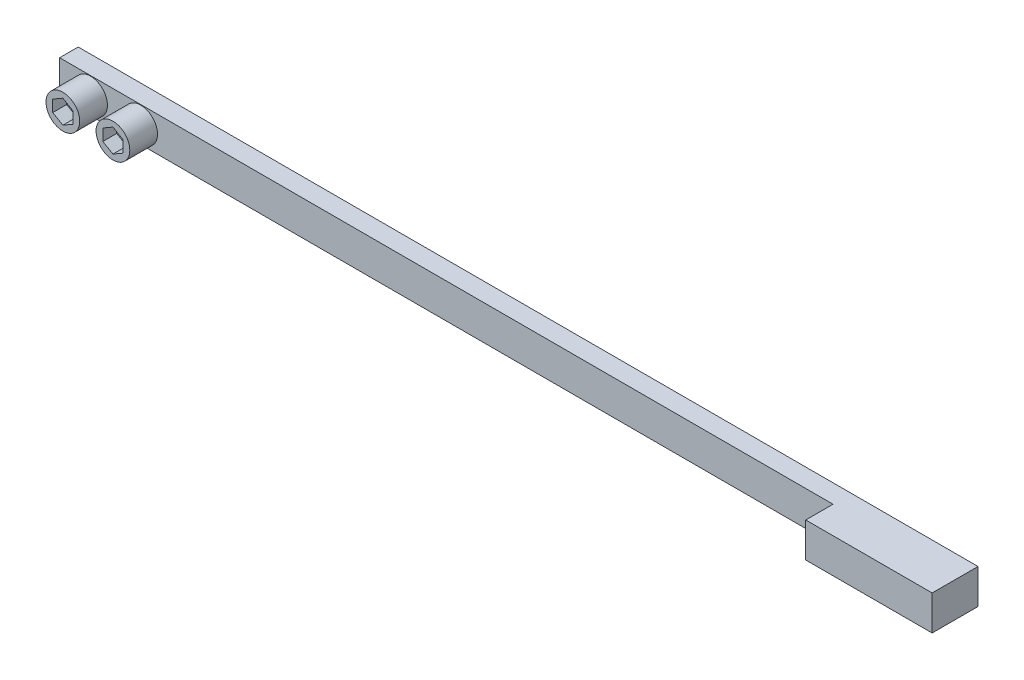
SolidWorks part; units mm, degrees
ref_plane "Front Plane" through (0, 0, 0) normal (0, 0, 1) x (1, 0, 0)
ref_plane "Top Plane" through (0, 0, 0) normal (0, 1, 0) x (1, 0, 0)
ref_plane "Right Plane" through (0, 0, 0) normal (1, 0, 0) x (0, 0, -1)
ref_plane "Plane1" through (-46.101, 0, 0) normal (1, 0, 0) x (0, 0, -1)
ref_plane "Plane2" through (0, 0, -0.9525) normal (0, 0, 1) x (1, 0, 0)
ref_plane "Plane3" through (0, -1.778, 0) normal (0, 1, 0) x (-1, 0, 0)
sketch "Sketch1" plane through (0, -1.778, 0) normal (0, 1, 0) x (-1, 0, 0)
  line L0 (46.101, -0.9525) -> (46.101, 0.9525)
  line L1 (46.101, 0.9525) -> (-33.147, 0.9525)
  line L2 (-33.147, 0.9525) -> (-33.147, 3.7465)
  line L3 (-33.147, 3.7465) -> (-46.101, 3.7465)
  line L4 (-46.101, 3.7465) -> (-46.101, -0.9525)
  line L5 (-46.101, -0.9525) -> (46.101, -0.9525)
extrude "Extrude1" add sketch "Sketch1" along normal blind 3.556
ref_plane "Plane4" through (0, 0, 0.9525) normal (0, 0, 1) x (1, 0, 0)
sketch "Sketch2" plane through (0, 0, 0.9525) normal (0, 0, 1) x (1, 0, 0)
  circle A0 centre (-42.926, 0) radius 1.7272
extrude "Extrude2" add sketch "Sketch2" along normal blind 2.8448
ref_plane "Plane5" through (0, 0, 3.7973) normal (0, 0, 1) x (1, 0, 0)
sketch "Sketch3" plane through (0, 0, 3.7973) normal (0, 0, 1) x (1, 0, 0)
  line L0 (-43.9623, 0.5983) -> (-43.9623, -0.5983)
  line L1 (-43.9623, -0.5983) -> (-42.926, -1.1966)
  line L2 (-42.926, -1.1966) -> (-41.8897, -0.5983)
  line L3 (-41.8897, -0.5983) -> (-41.8897, 0.5983)
  line L4 (-41.8897, 0.5983) -> (-42.926, 1.1966)
  line L5 (-42.926, 1.1966) -> (-43.9623, 0.5983)
extrude "Cut-Extrude1" cut sketch "Sketch3" against normal blind 1.4224
sketch "Sketch4" plane through (0, 0, 0.9525) normal (0, 0, 1) x (1, 0, 0)
  circle A0 centre (-37.7952, 0) radius 1.7272
sketch "Sketch5" plane through (0, 0, 3.7973) normal (0, 0, 1) x (1, 0, 0)
  line L0 (-38.8315, 0.5983) -> (-38.8315, -0.5983)
  line L1 (-38.8315, -0.5983) -> (-37.7952, -1.1966)
  line L2 (-37.7952, -1.1966) -> (-36.7589, -0.5983)
  line L3 (-36.7589, -0.5983) -> (-36.7589, 0.5983)
  line L4 (-36.7589, 0.5983) -> (-37.7952, 1.1966)
  line L5 (-37.7952, 1.1966) -> (-38.8315, 0.5983)
extrude "Extrude3" add sketch "Sketch4" along normal blind 2.8448
extrude "Cut-Extrude2" cut sketch "Sketch5" against normal blind 1.4224
